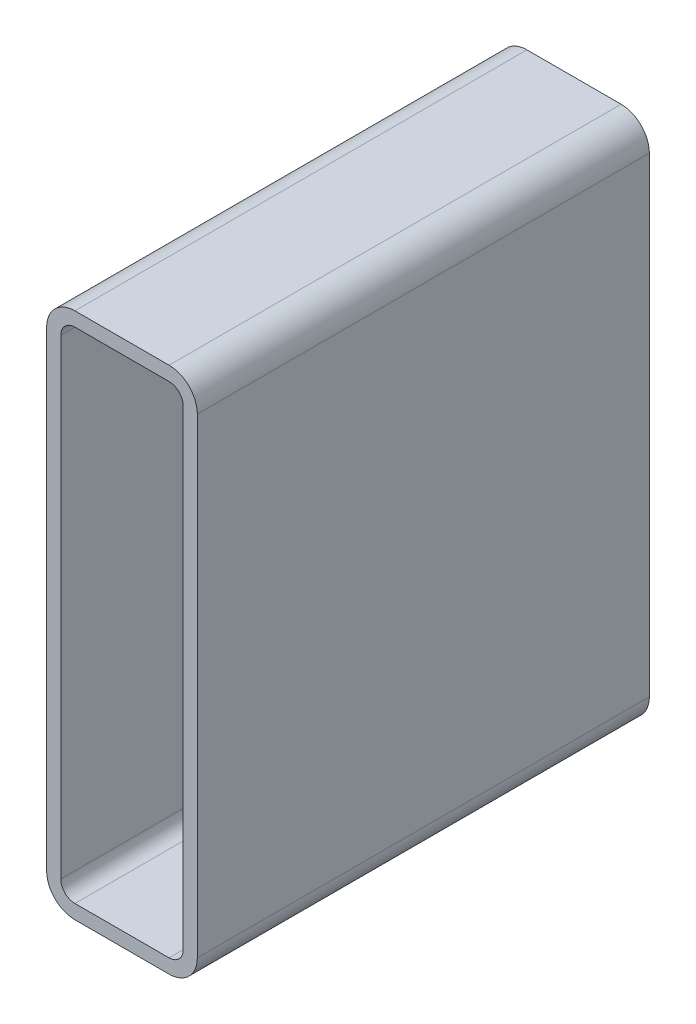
SolidWorks part; units mm, degrees
ref_plane "Front Plane" through (0, 0, 0) normal (0, 0, 1) x (1, 0, 0)
ref_plane "Top Plane" through (0, 0, 0) normal (0, 1, 0) x (1, 0, 0)
ref_plane "Right Plane" through (0, 0, 0) normal (1, 0, 0) x (0, 0, -1)
sketch "Sketch1" plane through (0, 0, 0) normal (0, 0, 1) x (1, 0, 0)
sketch_block_instance "HSS14x4x0.375-1"
sketch_block "HSS14x4x0.375"
extrude "Boss-Extrude1" add sketch "Sketch1" along normal blind 304.8
